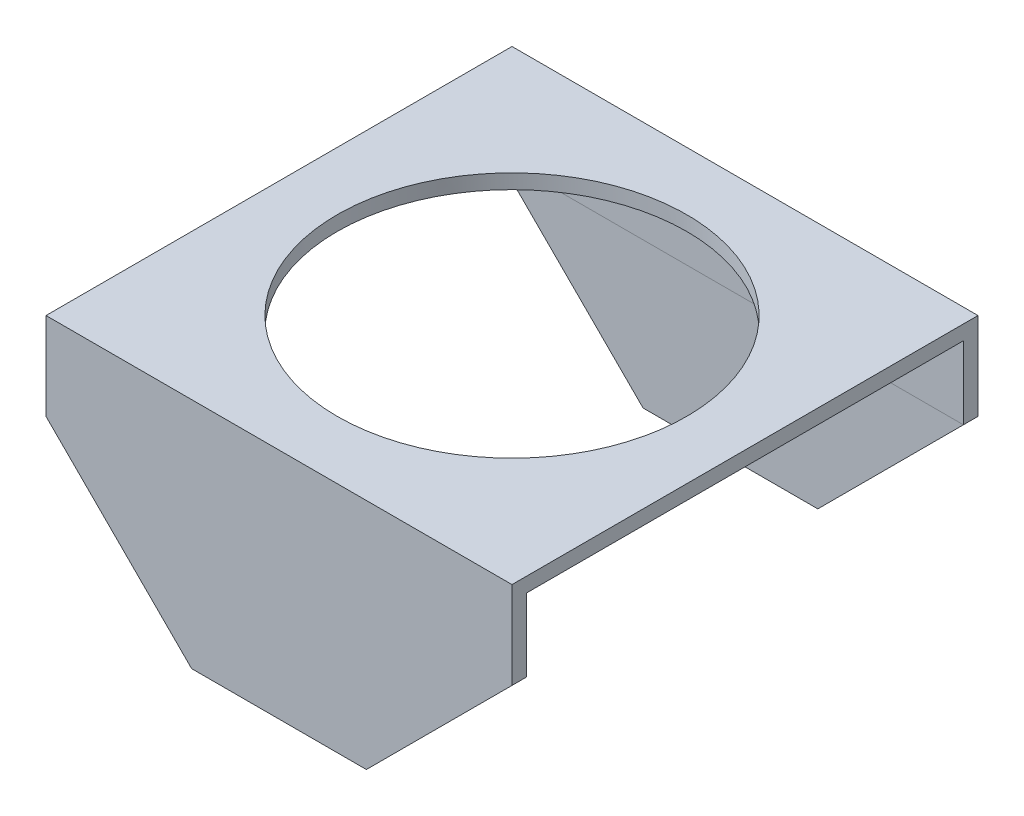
SolidWorks part; units mm, degrees
ref_plane "Plan de face" through (0, 0, 0) normal (0, 0, 1) x (1, 0, 0)
ref_plane "Plan de dessus" through (0, 0, 0) normal (0, 1, 0) x (1, 0, 0)
ref_plane "Plan de droite" through (0, 0, 0) normal (1, 0, 0) x (0, 0, -1)
sketch "Esquisse1" plane through (0, 0, 0) normal (0, 0, 1) x (1, 0, 0)
  line L1 (-8, 8) -> (8, 8)
  line L2 (-8, 8) -> (-8, 0)
  line L3 (-8, 0) -> (8, 0)
  line L4 (8, 8) -> (8, 0)
  dimension "D1" = 8
  dimension "D2" = 8
  dimension "D3" = 16
extrude "Extrusion1" add sketch "Esquisse1" against normal blind 16
sketch "Esquisse2" plane through (0, 0, 0) normal (0, 0, 1) x (1, 0, 0)
  line L0 (-8, 5) -> (-3, 0)
  line L1 (-8, 8) -> (-8, 0) construction
  line L2 (-8, 0) -> (8, 0) construction
  line L3 (-3, 0) -> (-8, 0)
  line L4 (-8, 0) -> (-8, 5)
  line L5 (0, 0) -> (0, 9.7456) construction
  line L6 (3, 0) -> (8, 0)
  line L7 (8, 5) -> (3, 0)
  line L8 (8, 0) -> (8, 5)
  dimension "D1" = 5
  dimension "D2" = 3
extrude "Enlèv. mat.-Extru.1" cut sketch "Esquisse2" against normal through all
sketch "Esquisse3" plane through (8, 0, 0) normal (1, 0, 0) x (0, 0, -1)
  line L0 (0.5, 7.5) -> (15.5, 7.5)
  line L1 (15.5, 7.5) -> (15.5, 5)
  line L2 (16, 5) -> (0, 5) construction
  line L3 (15.5, 5) -> (15.5, 0)
  line L4 (16, 0) -> (0, 0) construction
  line L5 (0.5, 7.5) -> (0.5, 5)
  line L6 (0.5, 5) -> (0.5, 0)
  line L7 (16, 8) -> (0, 8) construction
  line L8 (16, 5) -> (16, 8) construction
  line L9 (0, 5) -> (0, 8) construction
  dimension "D1" = 0.5
  dimension "D2" = 0.5
  dimension "D3" = 0.5
extrude "Enlèv. mat.-Extru.2" cut sketch "Esquisse3" against normal through all and the other way through all
sketch "Esquisse4" plane through (0, 8, 0) normal (0, 1, 0) x (-1, 0, 0)
  line L0 (-8, -16) -> (-8, 0) construction
  line L1 (-8, 0) -> (8, 0) construction
  circle A0 centre (0, -8) radius 6
  dimension "D1" = 12
  dimension "D2" = 8
  dimension "D3" = 8
extrude "Enlèv. mat.-Extru.3" cut sketch "Esquisse4" against normal blind 16
